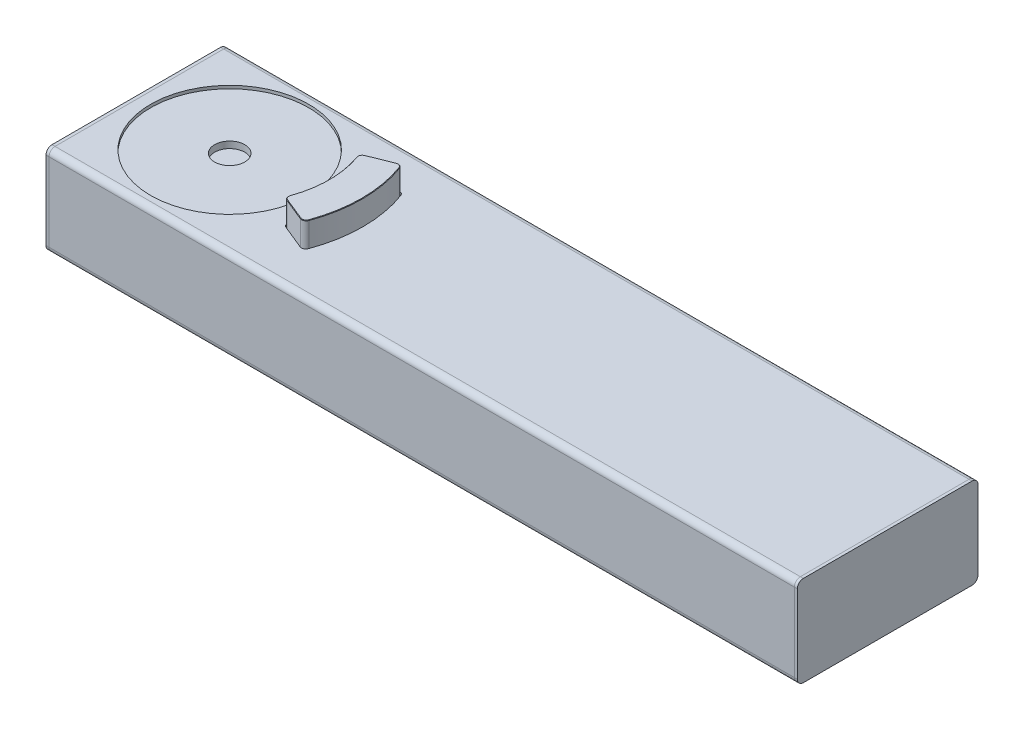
SolidWorks part; units mm, degrees
other "P01025001987-P1.0-AIR12SC-700A-2201-大臂-2-solid1"
other "P01035000993-P1.0-AIR12SC&AIR20SC-2302-大臂端盖-1-solid1"
other "P01025001958-P1.0-AIR12SC&AIR20SC-2202-J1大臂限位块-1-solid1"
other "P01035000993-P1.0-AIR12SC&AIR20SC-2302-大臂端盖-2-solid1"
ref_plane "前视基准面" through (0, 0, 0) normal (0, 0, 1) x (1, 0, 0)
ref_plane "上视基准面" through (0, 0, 0) normal (0, 1, 0) x (1, 0, 0)
ref_plane "右视基准面" through (0, 0, 0) normal (1, 0, 0) x (0, 0, -1)
imported_body "输入1"
imported_body "输入2"
imported_body "输入3"
imported_body "输入4"
move or copy body "实体-移动/复制1" bodies to move or copy 101 placed by mates yes
